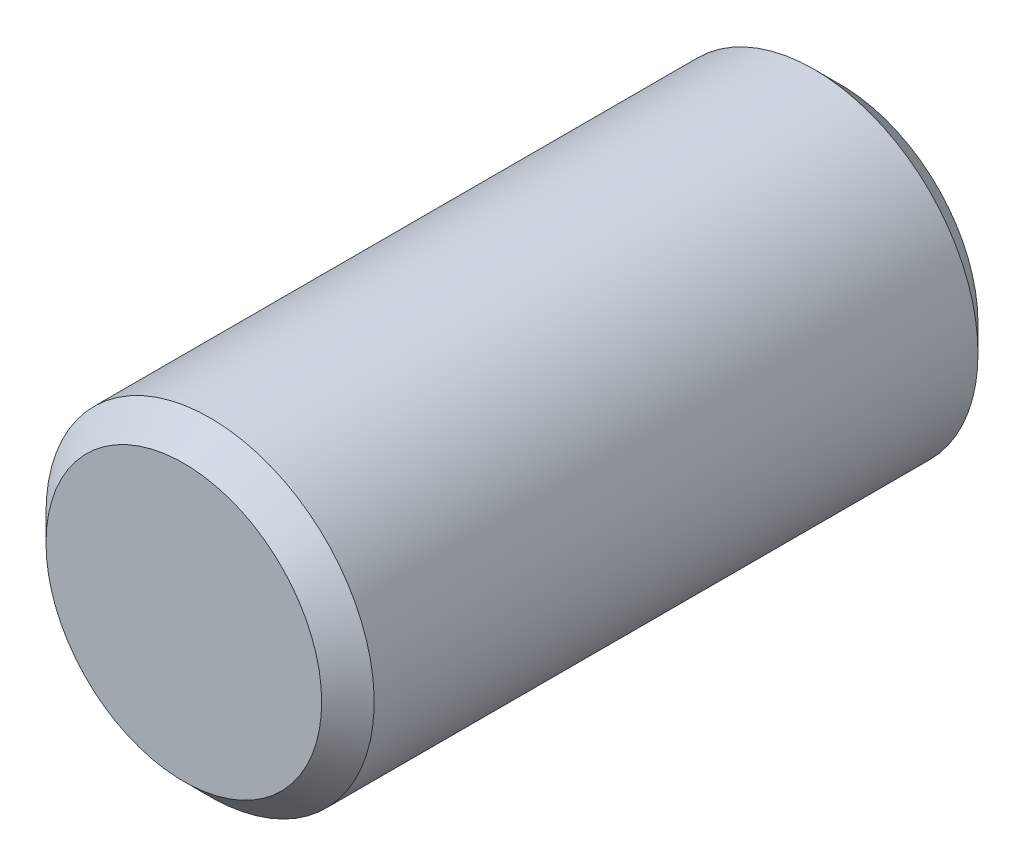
SolidWorks part; units mm, degrees
ref_plane "Face" through (0, 0, 0) normal (0, 0, 1) x (1, 0, 0)
ref_plane "Dessus" through (0, 0, 0) normal (0, 1, 0) x (1, 0, 0)
ref_plane "Droite" through (0, 0, 0) normal (1, 0, 0) x (0, 0, -1)
sketch "Esquisse1" plane through (0, 0, 0) normal (0, 0, 1) x (1, 0, 0)
  circle A0 centre (0, 0) radius 1.25
  dimension "D1" = 2.5
extrude "Extrusion1" add sketch "Esquisse1" along normal blind 5
chamfer "Chanfrein1" distance 0.2 angle 45 2 edges at (1.25, 0, 0) (1.25, 0, 5)
